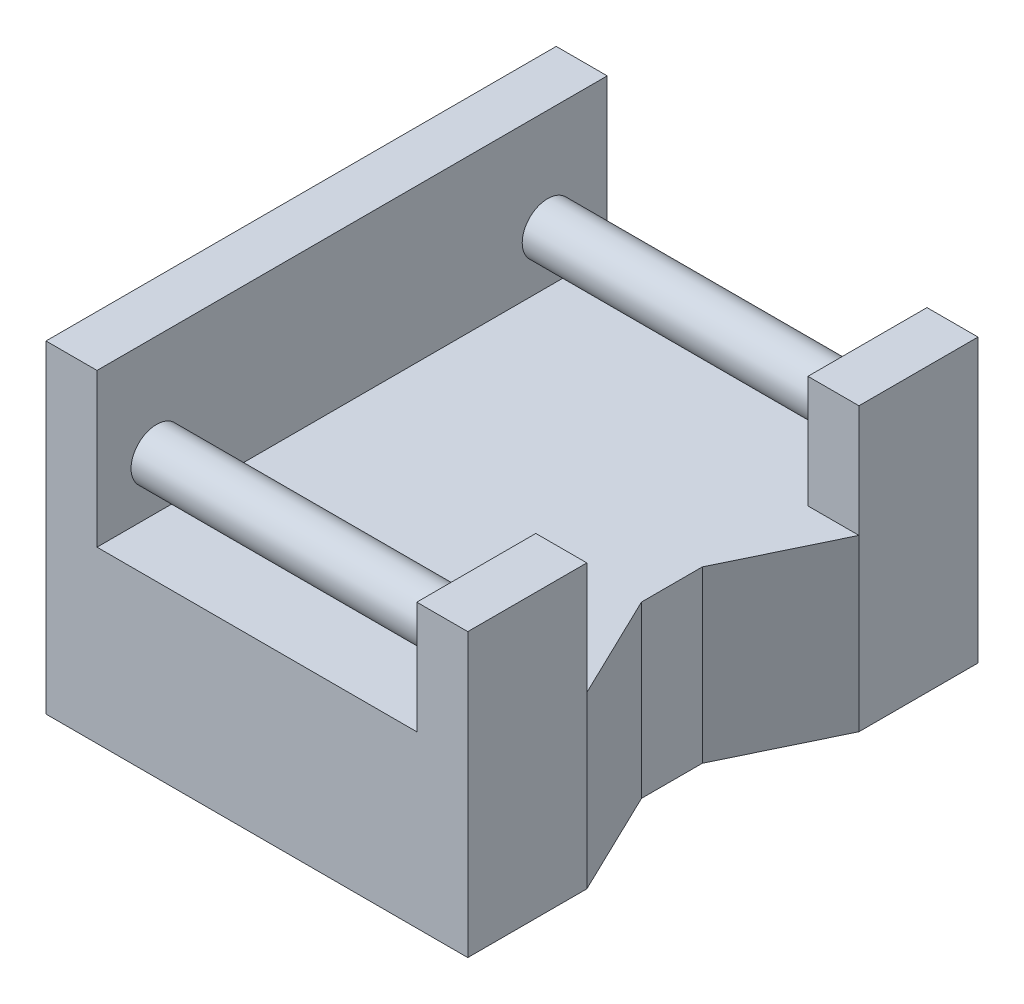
SolidWorks part; units mm, degrees
ref_plane "Piano frontale" through (0, 0, 0) normal (0, 0, 1) x (1, 0, 0)
ref_plane "Piano superiore" through (0, 0, 0) normal (0, 1, 0) x (1, 0, 0)
ref_plane "Piano destro" through (0, 0, 0) normal (1, 0, 0) x (0, 0, -1)
sketch "Schizzo1" plane through (0, 0, 0) normal (0, 1, 0) x (1, 0, 0)
  line L0 (0, 0) -> (0, 15)
  line L1 (0, 15) -> (12.4, 15)
  line L2 (12.4, 15) -> (12.4, 11.5)
  line L3 (12.4, 11.5) -> (10.9, 8.3934)
  line L4 (10.9, 8.3934) -> (10.9, 6.6066)
  line L5 (10.9, 6.6066) -> (12.4, 3.5)
  line L6 (12.4, 3.5) -> (12.4, 0)
  line L7 (12.4, 0) -> (0, 0)
  point P10 (12.4, 13.25)
  dimension "D1" = 12.4
  dimension "D2" = 12.4
  dimension "D3" = 15
  dimension "D4" = 3.5
  dimension "D5" = 3.5
  dimension "D6" = 1.5
  dimension "D9" = 1.7868
extrude "Estrusione-Estrusione2" add sketch "Schizzo1" along normal blind 5 contours L7 L6 L5 L4 L3 L2 L1 L0
sketch "Schizzo4" plane through (0, 5, 0) normal (0, 1, 0) x (1, 0, 0)
  line L0 (0, 15) -> (12.4, 15) construction
  line L1 (1.5, 15) -> (0, 15)
  line L2 (1.5, 15) -> (1.5, 0)
  line L3 (1.5, 0) -> (0, 0)
  line L4 (0, 15) -> (0, 0)
  dimension "D1" = 15
  dimension "D2" = 1.5
extrude "Estrusione-Estrusione4" add sketch "Schizzo4" along normal blind 4.5
sketch "Schizzo5" plane through (0, 5, 0) normal (0, 1, 0) x (1, 0, 0)
  line L0 (12.4, 0) -> (1.5, 0) construction
  line L1 (12.4, 3.5) -> (10.9, 3.5)
  line L2 (12.4, 3.5) -> (12.4, 0)
  line L3 (12.4, 0) -> (10.9, 0)
  line L4 (10.9, 3.5) -> (10.9, 0)
  line L6 (12.4, 15) -> (10.9, 15)
  line L7 (12.4, 15) -> (12.4, 11.5)
  line L8 (12.4, 11.5) -> (10.9, 11.5)
  line L9 (10.9, 15) -> (10.9, 11.5)
  dimension "D1" = 1.5
  dimension "D2" = 1.5
extrude "Estrusione-Estrusione5" add sketch "Schizzo5" along normal blind 3.3
sketch "Schizzo7" plane through (10.9, 0, 0) normal (-1, 0, 0) x (0, 0, 1)
  line L0 (0, 8.3) -> (0, 5) construction
  line L1 (-3.5, 8.3) -> (0, 8.3) construction
  line L2 (-15, 8.3) -> (-15, 5) construction
  line L3 (-15, 8.3) -> (-11.5, 8.3) construction
  line L4 (-3.5, 5) -> (0, 5) construction
  line L5 (-15, 5) -> (-11.5, 5) construction
  circle A0 centre (-1.75, 6.5) radius 0.75
  circle A1 centre (-13.25, 6.5) radius 0.75
  dimension "D5" = 1.5
  dimension "D6" = 1.5
  dimension "D1" = 1.75
  dimension "D2" = 1.8
  dimension "D3" = 1.75
  dimension "D4" = 1.8
  dimension "D7" = 1.5
  dimension "D8" = 1.5
extrude "Estrusione-Estrusione6" add sketch "Schizzo7" along normal blind 10
ref_plane "Piano1" through (1.5, 5, -15) normal (1, 0, 0) x (0, 0, -1)
scale "Scala2" scale about centroid uniform scaling yes scale factor 10
sketch "Schizzo9" plane through (-50.9815, 0, 0) normal (-1, 0, 0) x (0, 0, 1)
  line L1 (-82.5, 66.082) -> (67.5, 66.082) construction
  line L3 (-7.5, 66.082) -> (-7.5, -28.918)
  line L4 (67.5, -28.918) -> (-82.5, -28.918) construction
ref_plane "Piano2" through (0, 0, -7.5) normal (0, 0, -1) x (0, -1, 0)
